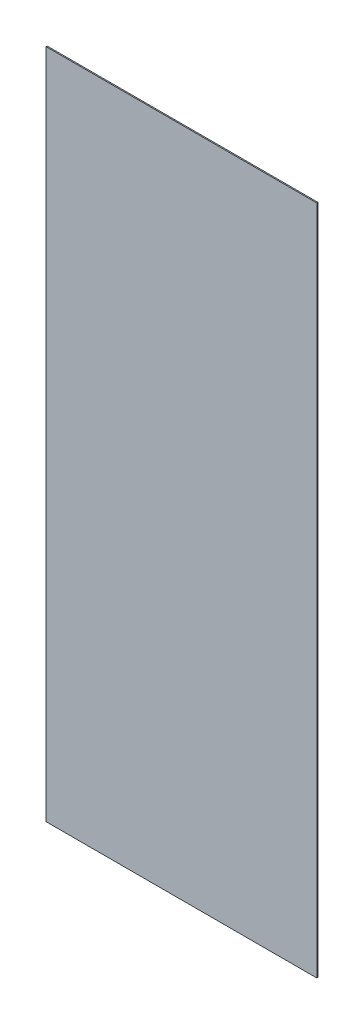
SolidWorks part; units mm, degrees
ref_plane "Front Plane" through (0, 0, 0) normal (0, 0, 1) x (1, 0, 0)
ref_plane "Top Plane" through (0, 0, 0) normal (0, 1, 0) x (1, 0, 0)
ref_plane "Right Plane" through (0, 0, 0) normal (1, 0, 0) x (0, 0, -1)
sketch "Sketch1" plane through (0, 0, 0) normal (0, 0, 1) x (1, 0, 0)
  line L1 (2.54, 1524) -> (-612.14, 1524)
  line L2 (2.54, 1524) -> (2.54, 0)
  line L3 (2.54, 0) -> (-612.14, 0)
  line L4 (-612.14, 1524) -> (-612.14, 0)
extrude "Extrude1" add sketch "Sketch1" along normal blind 2.54
